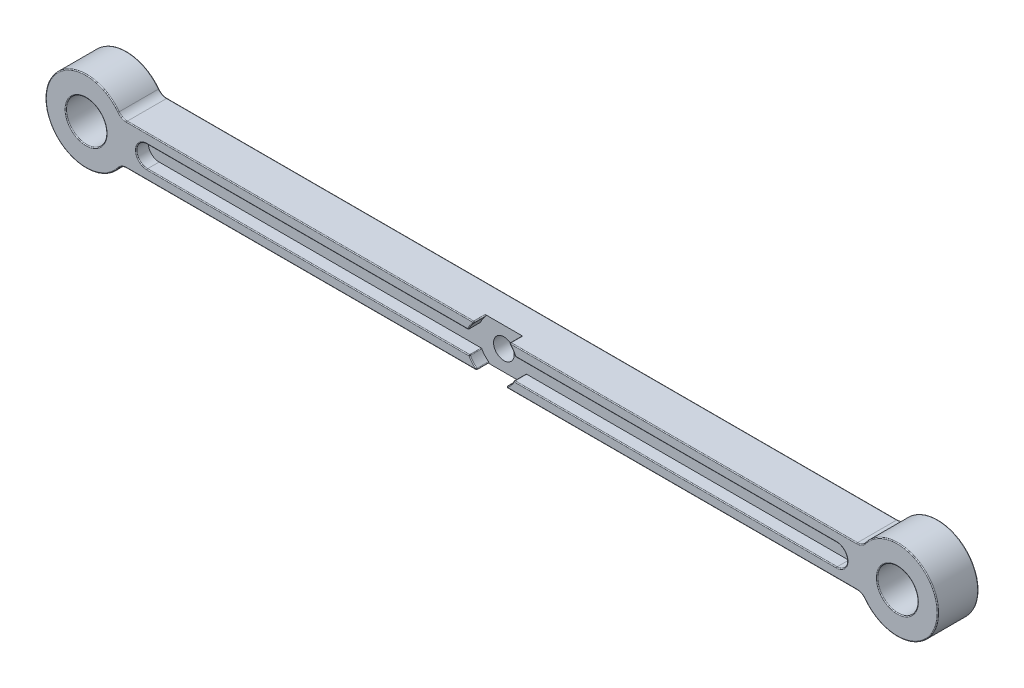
SolidWorks part; units mm, degrees
ref_plane "Front Plane" through (0, 0, 0) normal (0, 0, 1) x (1, 0, 0)
ref_plane "Top Plane" through (0, 0, 0) normal (0, 1, 0) x (1, 0, 0)
ref_plane "Right Plane" through (0, 0, 0) normal (1, 0, 0) x (0, 0, -1)
sketch "Sketch1" plane through (0, 0, 0) normal (0, 0, 1) x (1, 0, 0)
  line L0 (0, 0) -> (0, 57.7863) construction
  line L3 (-116.0015, 6.35) -> (116.0015, 6.35)
  line L4 (-116.0015, -6.35) -> (116.0015, -6.35)
  arc A0 (116.0015, 6.35) -> (116.0015, -6.35) centre (127, 0) cw
  circle A2 centre (-127, 0) radius 6.35
  circle A3 centre (127, 0) radius 6.35
  arc A4 (-116.0015, 6.35) -> (-116.0015, -6.35) centre (-127, 0) ccw
  dimension "D3" = 12.7
  dimension "D5" = 12.7
  dimension "D1" = 254
  dimension "D2" = 12.7
extrude "Boss-Extrude1" add sketch "Sketch1" along normal mid plane 12.7
sketch "Sketch2" plane through (0, 0, 6.35) normal (0, 0, 1) x (1, 0, 0)
  line L0 (0, 0) -> (0, -46.3841) construction
  line L6 (-107.95, -3.3655) -> (107.95, -3.3655)
  line L22 (107.95, 3.3655) -> (-107.95, 3.3655)
  arc A0 (-107.95, 3.3655) -> (-107.95, -3.3655) centre (-107.95, 0) ccw
  arc A1 (107.95, 3.3655) -> (107.95, -3.3655) centre (107.95, 0) cw
  dimension "D2" = 215.9
  dimension "D1" = 6.731
extrude "Cut-Extrude1" cut sketch "Sketch2" against normal blind 3.81
sketch "Sketch4" plane through (0, 0, 6.35) normal (0, 0, 1) x (1, 0, 0)
  circle A0 centre (0, 0.4072) radius 7.9375
  dimension "D1" = 15.875
  dimension "D2" = 0.4072
extrude "Cut-Extrude5" cut sketch "Sketch4" against normal up to surface (3.81 mm away)
mirror "Mirror1" about plane through (0, 0, 0) normal (0, 0, 1) of "Cut-Extrude1"
fillet "Fillet2" radius 3.175 4 edges at (116.0015, 6.35, 0) (116.0015, -6.35, 0) (-116.0015, -6.35, 0) (-116.0015, 6.35, 0)
sketch "Sketch5" plane through (0, 0, 2.54) normal (0, 0, 1) x (1, 0, 0)
  line L0 (0, 6.35) -> (0, -6.35) construction
  line L1 (5.2619, 6.35) -> (-5.2619, 6.35) construction
  line L2 (-4.1646, -6.35) -> (4.1646, -6.35) construction
  circle A0 centre (0, 0) radius 3.2385
  dimension "D1" = 6.477
extrude "Cut-Extrude6" cut sketch "Sketch5" against normal through all
fillet "Fillet1" radius 0.254 44 edges at (-120.65, 0, -6.35) (-120.65, 0, 6.35) (133.35, 0, -6.35) (133.35, 0, 6.35) (-111.3155, 0, 6.35) (-57.4668, -3.3655, 6.35) (111.3155, 0, 6.35) (57.6578, 3.3655, 6.35) (57.4668, -3.3655, 6.35) (-57.6578, 3.3655, 6.35) (-59.7809, 6.35, 6.35) (59.2323, -6.35, 6.35) (-5.7704, -5.0432, 6.35) (5.7704, -5.0432, 6.35) (6.4877, 4.9804, 6.35) (-6.4877, 4.9804, 6.35) (-4.1646, -6.35, 4.445) (-6.9836, -3.3655, 4.445) (4.1646, -6.35, 4.445) (6.9836, -3.3655, 4.445) (5.2619, 6.35, 4.445) (7.3656, 3.3655, 4.445) (-5.2619, 6.35, 4.445) (-7.3656, 3.3655, 4.445) (-111.3155, 0, -6.35) (0, -3.3655, -6.35) (111.3155, 0, -6.35) (0, 3.3655, -6.35) (59.7809, 6.35, 6.35) (0, 6.35, -6.35) (139.7, 0, -6.35) (139.7, 0, 6.35) (-59.2323, -6.35, 6.35) (0, -6.35, -6.35) (-139.7, 0, -6.35) (-139.7, 0, 6.35) (115.7199, 6.6852, -6.35) (115.7199, 6.6852, 6.35) (115.7199, -6.6852, -6.35) (115.7199, -6.6852, 6.35) (-115.7199, -6.6852, -6.35) (-115.7199, -6.6852, 6.35) (-115.7199, 6.6852, -6.35) (-115.7199, 6.6852, 6.35)
